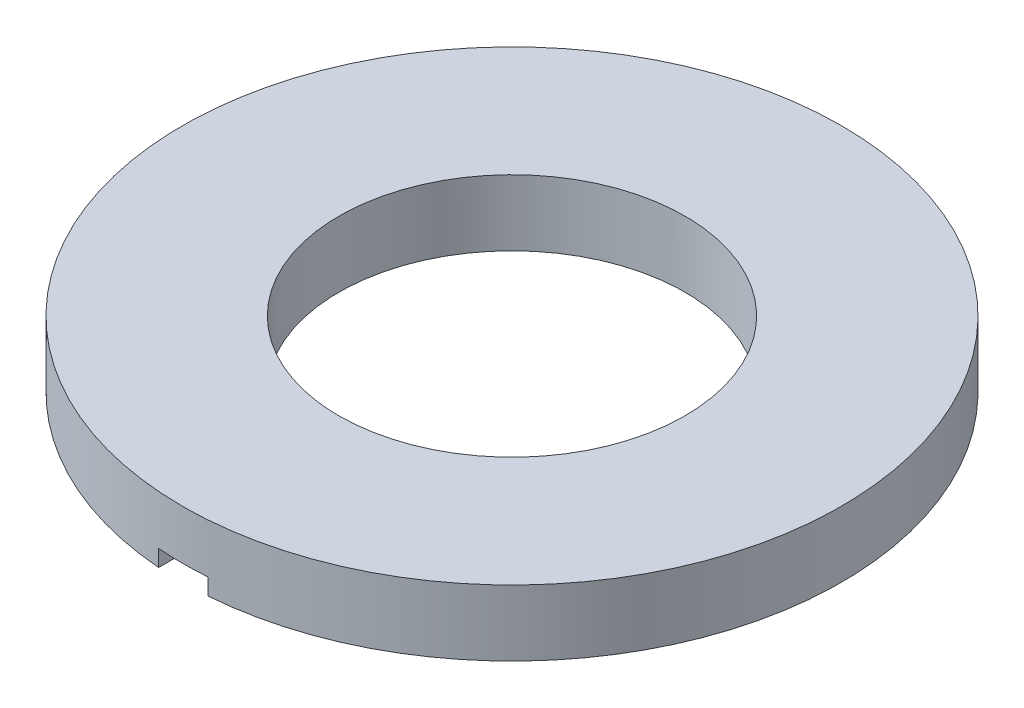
SolidWorks part; units mm, degrees
ref_plane "Front Plane" through (0, 0, 0) normal (0, 0, 1) x (1, 0, 0)
ref_plane "Top Plane" through (0, 0, 0) normal (0, 1, 0) x (1, 0, 0)
ref_plane "Right Plane" through (0, 0, 0) normal (1, 0, 0) x (0, 0, -1)
sketch "Sketch1" plane through (0, 0, 0) normal (0, 1, 0) x (1, 0, 0)
  circle A0 centre (0, 0) radius 5.25
  circle A1 centre (0, 0) radius 10
  dimension "D1" = 10.5
  dimension "D2" = 20
extrude "Extrude1" add sketch "Sketch1" along normal blind 2
sketch "Sketch2" plane through (0, 0, 0) normal (0, -1, 0) x (1, 0, 0)
  line L1 (-0.75, 0.5) -> (0.75, 0.5)
  line L2 (-0.75, 0.5) -> (-0.75, 10)
  line L3 (-0.75, 10) -> (0.75, 10)
  line L4 (0.75, 0.5) -> (0.75, 10)
  line L5 (-0.75, 0.5) -> (0.75, 10) construction
  line L6 (-0.75, 10) -> (0.75, 0.5) construction
  circle A0 centre (0, 0) radius 5.25 construction
  circle A1 centre (0, 0) radius 10 construction
  point P0 (0, 5.25)
  dimension "D1" = 1.5
extrude "Cut-Extrude1" cut sketch "Sketch2" against normal blind 0.5
